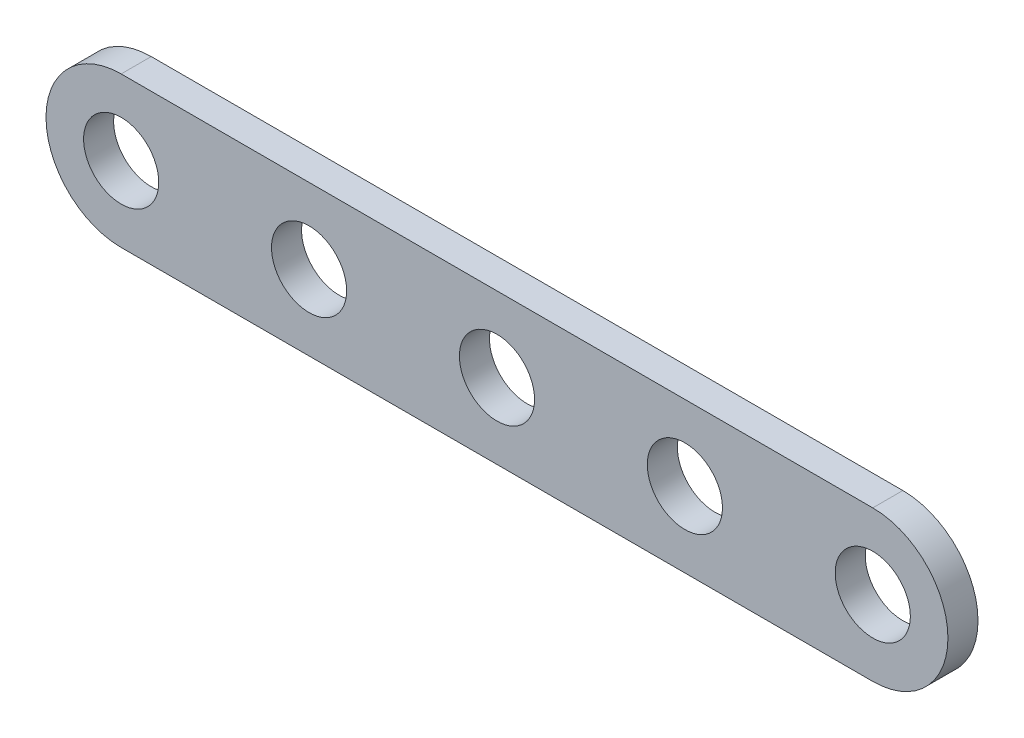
SolidWorks part; units mm, degrees
ref_plane "Front" through (0, 0, 0) normal (0, 0, 1) x (1, 0, 0)
ref_plane "Top" through (0, 0, 0) normal (0, 1, 0) x (1, 0, 0)
ref_plane "Right" through (0, 0, 0) normal (1, 0, 0) x (0, 0, -1)
sketch "Sketch1" plane through (0, 0, 0) normal (0, 0, 1) x (1, 0, 0)
  line L0 (250, 222.6284) -> (250, -151.5336) construction
  line L1 (0, 0) -> (500, 0)
  line L3 (0, 100) -> (500, 100)
  arc A0 (0, 100) -> (0, 0) centre (0, 50) ccw
  arc A1 (500, 100) -> (500, 0) centre (500, 50) cw
  point P1 (250, 0)
  point P10 (250, 100)
  dimension "D2" = 500
  dimension "D1" = 100
extrude "Base-Extrude" add sketch "Sketch1" along normal mid plane 20
sketch "Sketch2" plane through (0, 0, 10) normal (0, 0, 1) x (1, 0, 0)
  circle A0 centre (0, 50) radius 25
  arc A1 (0, 100) -> (0, 0) centre (0, 50) ccw construction
  dimension "D1" = 50
extrude "Cut-Extrude1" cut sketch "Sketch2" against normal through all
pattern_linear "LPattern1" count 5 spacing 125 along (1, 0, 0) of "Cut-Extrude1"
sketch "Sketch3" plane through (0, 0, 0) normal (0, 0, 1) x (1, 0, 0)
  line L0 (500, 50) -> (626.1226, 50) construction
  line L1 (500, 50) -> (500, 183.3819) construction
  circle A0 centre (500, 50) radius 25 construction
  circle A1 centre (500, 50) radius 25 construction
equation "\"D3@LPattern1\" = \"D2@Sketch1\" / (\"D1@LPattern1\"-1)"
